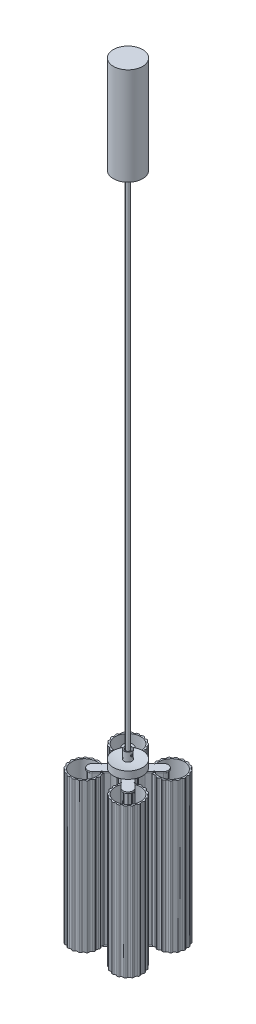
SolidWorks part; units mm, degrees
ref_plane "Alzado" through (0, 0, 0) normal (0, 0, 1) x (1, 0, 0)
ref_plane "Planta" through (0, 0, 0) normal (0, 1, 0) x (1, 0, 0)
ref_plane "Vista lateral" through (0, 0, 0) normal (1, 0, 0) x (0, 0, -1)
imported_body "Drawing1 (1).iges-1/Drawing1 (1)1.iges-1-surface1"
imported_body "Drawing1 (1).iges-1/Drawing1 (1)6.iges-1-solid1"
imported_body "Drawing1 (1).iges-1/Drawing1 (1)7.iges-1-solid1"
imported_body "Drawing1 (1).iges-1/Drawing1 (1)8.iges-1-surface1"
imported_body "Drawing1 (1).iges-1/Drawing1 (1)9.iges-1-surface1"
imported_body "Drawing1 (1).iges-1/Drawing1 (1)10.iges-1-surface1"
imported_body "Drawing1 (1).iges-1/Drawing1 (1)11.iges-1-surface1"
imported_body "Drawing1 (1).iges-1/Drawing1 (1)12.iges-1-surface1"
imported_body "Drawing1 (1).iges-1/Drawing1 (1)13.iges-1-surface1"
imported_body "Drawing1 (1).iges-1/Drawing1 (1)14.iges-1-surface1"
imported_body "Drawing1 (1).iges-1/Drawing1 (1)28.iges-1-solid1"
imported_body "Drawing1 (1).iges-1/Drawing1 (1)29.iges-1-solid1"
imported_body "Drawing1 (1).iges-1/Drawing1 (1)30.iges-1-solid1"
imported_body "Drawing1 (1).iges-1/Drawing1 (1)31.iges-1-solid1"
imported_body "Drawing1 (1).iges-1/Drawing1 (1)32.iges-1-solid1"
imported_body "Drawing1 (1).iges-1/Drawing1 (1)33.iges-1-solid1"
imported_body "Drawing1 (1).iges-1/Drawing1 (1)34.iges-1-solid1"
ref_plane "Plano1" through (0, 165, 0) normal (0, 1, 0) x (1, 0, 0)
sketch "Croquis1" plane through (0, 165, 0) normal (0, 1, 0) x (1, 0, 0)
  line L0 (2609.0394, 5910.9704) -> (2696.0135, 5997.9445) construction
  arc A12 (2608.6858, 5924.9004) -> (2622.9694, 5910.6169) centre (2616.1904, 5918.1214) ccw construction
  arc A13 (2696.3671, 5984.0145) -> (2682.0835, 5998.2981) centre (2688.8625, 5990.7936) ccw construction
  circle A14 centre (2697.313, 5999.244) radius 30
  circle A15 centre (2697.313, 5999.244) radius 26
  circle A16 centre (2652.5612, 5954.4547) radius 30 construction
  circle A17 centre (2697.3505, 5909.7029) radius 26
  circle A18 centre (2697.3505, 5909.7029) radius 30
  circle A19 centre (2607.8094, 5909.6654) radius 26
  circle A20 centre (2607.8094, 5909.6654) radius 30
  circle A21 centre (2607.7719, 5999.2065) radius 26
  circle A22 centre (2607.7719, 5999.2065) radius 30
  point P25 (2652.5612, 5954.4547)
  dimension "D1" = 60
  dimension "D2" = 52
  dimension "D3" = 4
extrude "Saliente-Extruir1" add sketch "Croquis1" along normal blind 306 separate body
sketch "Croquis2" plane through (0, 471, 0) normal (0, 1, 0) x (1, 0, 0)
  circle A47 centre (5954.4547, -2652.5612) radius 30
  circle A48 centre (-2652.5612, -5954.4547) radius 30
  circle A49 centre (-5954.4547, 2652.5612) radius 30
  circle A107 centre (2652.5612, 5954.4547) radius 30 construction
  circle A108 centre (2697.313, 5999.244) radius 32 construction
  circle A109 centre (2697.313, 6031.244) radius 4
  circle A110 centre (2708.8727, 6029.0831) radius 4
  circle A111 centre (2718.8713, 6022.8923) radius 4
  circle A112 centre (2725.9582, 6013.5076) radius 4
  circle A113 centre (2729.1765, 6002.1966) radius 4
  circle A114 centre (2728.0914, 5990.4868) radius 4
  circle A115 centre (2722.8495, 5979.9597) radius 4
  circle A116 centre (2714.1588, 5972.0371) radius 4
  circle A117 centre (2703.193, 5967.7889) radius 4
  circle A118 centre (2691.433, 5967.7889) radius 4
  circle A121 centre (2666.5346, 5990.4868) radius 4
  circle A122 centre (2665.4495, 6002.1966) radius 4
  circle A123 centre (2668.6678, 6013.5076) radius 4
  circle A124 centre (2675.7547, 6022.8923) radius 4
  circle A125 centre (2685.7533, 6029.0831) radius 4
  circle A126 centre (2680.4672, 5972.0371) radius 4
  circle A127 centre (2671.7764, 5979.9597) radius 4
  circle A128 centre (2688.5933, 5940.4813) radius 4
  circle A129 centre (2700.3031, 5941.5664) radius 4
  circle A130 centre (2711.6142, 5938.3481) radius 4
  circle A131 centre (2720.9988, 5931.2612) radius 4
  circle A132 centre (2727.1896, 5921.2626) radius 4
  circle A133 centre (2729.3505, 5909.7029) radius 4
  circle A134 centre (2727.1896, 5898.1432) radius 4
  circle A135 centre (2720.9988, 5888.1446) radius 4
  circle A136 centre (2711.6142, 5881.0577) radius 4
  circle A137 centre (2700.3031, 5877.8394) radius 4
  circle A138 centre (2688.5933, 5878.9245) radius 4
  circle A139 centre (2678.0662, 5884.1663) radius 4
  circle A140 centre (2670.1436, 5892.8571) radius 4
  circle A141 centre (2665.8954, 5903.8229) radius 4
  circle A142 centre (2665.8954, 5915.5829) radius 4
  circle A143 centre (2638.5878, 5918.4226) radius 4
  circle A144 centre (2639.6729, 5906.7128) radius 4
  circle A145 centre (2636.4546, 5895.4017) radius 4
  circle A146 centre (2629.3677, 5886.0171) radius 4
  circle A147 centre (2619.3691, 5879.8263) radius 4
  circle A148 centre (2607.8094, 5877.6654) radius 4
  circle A149 centre (2596.2497, 5879.8263) radius 4
  circle A150 centre (2586.2511, 5886.0171) radius 4
  circle A151 centre (2579.1642, 5895.4017) radius 4
  circle A152 centre (2575.9459, 5906.7128) radius 4
  circle A153 centre (2577.031, 5918.4226) radius 4
  circle A154 centre (2582.2729, 5928.9497) radius 4
  circle A155 centre (2590.9636, 5936.8723) radius 4
  circle A156 centre (2601.9294, 5941.1205) radius 4
  circle A157 centre (2613.6894, 5941.1205) radius 4
  circle A158 centre (2616.5291, 5968.4281) radius 4
  circle A159 centre (2604.8193, 5967.343) radius 4
  circle A160 centre (2593.5083, 5970.5613) radius 4
  circle A161 centre (2584.1236, 5977.6482) radius 4
  circle A162 centre (2577.9328, 5987.6468) radius 4
  circle A163 centre (2575.7719, 5999.2065) radius 4
  circle A164 centre (2577.9328, 6010.7662) radius 4
  circle A165 centre (2584.1236, 6020.7647) radius 4
  circle A166 centre (2593.5083, 6027.8517) radius 4
  circle A167 centre (2604.8193, 6031.07) radius 4
  circle A168 centre (2616.5291, 6029.9849) radius 4
  circle A169 centre (2627.0562, 6024.743) radius 4
  circle A170 centre (2634.9788, 6016.0523) radius 4
  circle A171 centre (2639.227, 6005.0865) radius 4
  circle A172 centre (2639.227, 5993.3265) radius 4
  point P33 (0, 0)
  point P47 (2697.313, 5999.244)
  point P161 (2652.5612, 5954.4547)
  dimension "D1" = 64
  dimension "D2" = 17
  dimension "D3" = 4
extrude "Cortar-Extruir1" cut sketch "Croquis2" against normal blind 306
ref_plane "Plano2" through (0, 175, 0) normal (0, 1, 0) x (1, 0, 0)
ref_plane "Plano3" through (0, 460, 0) normal (0, 1, 0) x (1, 0, 0)
fillet "Redondeo1" radius 4 30 edges at (2591.4855, 318, -6024.4008) (2597.4811, 318, -6027.3863) (2601.6866, 318, -6028.5828) (2608.3557, 318, -6029.2008) (2612.7094, 318, -6028.7974) (2619.1515, 318, -6026.9645) (2623.0655, 318, -6025.0155) (2628.4104, 318, -6020.9792) (2631.356, 318, -6017.748) (2634.8819, 318, -6012.0535) (2636.4614, 318, -6007.9764) (2637.6921, 318, -6001.3927) (2637.6921, 318, -5997.0203) (2636.4614, 318, -5990.4366) (2619.1515, 318, -5971.4485) (2612.7094, 318, -5969.6156) (2608.3557, 318, -5969.2122) (2601.6866, 318, -5969.8302) (2597.4811, 318, -5971.0267) (2591.4855, 318, -5974.0121) (2587.9963, 318, -5976.6471) (2583.4841, 318, -5981.5968) (2581.1823, 318, -5985.3143) (2578.7628, 318, -5991.5597) (2583.4841, 318, -6016.8162) (2587.9963, 318, -6021.7659) (2578.7628, 318, -6006.8533) (2581.1823, 318, -6013.0987) (2577.9594, 318, -5995.8576) (2577.9594, 318, -6002.5553)
fillet "Redondeo2" radius 4 30 edges at (2667.4303, 318, -5911.8891) (2668.661, 318, -5918.4728) (2668.661, 318, -5900.933) (2667.4303, 318, -5907.5167) (2673.7664, 318, -5891.1614) (2670.2405, 318, -5896.8559) (2682.0569, 318, -5883.8939) (2676.712, 318, -5887.9301) (2692.413, 318, -5880.112) (2685.9709, 318, -5881.9449) (2703.4358, 318, -5880.3266) (2696.7667, 318, -5879.7086) (2713.6369, 318, -5884.5086) (2707.6413, 318, -5881.5231) (2721.6383, 318, -5892.0932) (2717.1261, 318, -5887.1435) (2726.3596, 318, -5902.0561) (2723.9401, 318, -5895.8107) (2727.163, 318, -5913.0518) (2727.163, 318, -5906.354) (2723.9401, 318, -5923.5951) (2726.3596, 318, -5917.3497) (2685.9709, 318, -5937.4609) (2692.413, 318, -5939.2938) (2696.7667, 318, -5939.6972) (2703.4358, 318, -5939.0792) (2707.6413, 318, -5937.8827) (2713.6369, 318, -5934.8972) (2717.1261, 318, -5932.2623) (2721.6383, 318, -5927.3126)
fillet "Redondeo3" radius 4 30 edges at (2609.9956, 318, -5939.5856) (2616.5793, 318, -5938.3549) (2599.0395, 318, -5938.3549) (2605.6232, 318, -5939.5856) (2589.2679, 318, -5933.2495) (2594.9624, 318, -5936.7754) (2582.0004, 318, -5924.959) (2586.0367, 318, -5930.3039) (2630.3688, 318, -5889.8898) (2625.4191, 318, -5885.3776) (2635.9892, 318, -5899.3746) (2633.0037, 318, -5893.379) (2637.8037, 318, -5910.2492) (2637.1857, 318, -5903.58) (2635.5674, 318, -5921.045) (2637.4003, 318, -5914.6029) (2621.7016, 318, -5883.0758) (2615.4562, 318, -5880.6563) (2611.1583, 318, -5879.8529) (2604.4606, 318, -5879.8529) (2600.1626, 318, -5880.6563) (2593.9172, 318, -5883.0758) (2590.1997, 318, -5885.3776) (2585.25, 318, -5889.8898) (2578.2185, 318, -5914.6029) (2580.0514, 318, -5921.045) (2578.4331, 318, -5903.58) (2577.8151, 318, -5910.2492) (2582.6151, 318, -5893.379) (2579.6296, 318, -5899.3746)
fillet "Redondeo4" radius 4 30 edges at (2695.1268, 318, -5969.3238) (2688.5431, 318, -5970.5545) (2706.0829, 318, -5970.5545) (2699.4992, 318, -5969.3238) (2715.8545, 318, -5975.6599) (2710.16, 318, -5972.134) (2723.122, 318, -5983.9504) (2719.0857, 318, -5978.6055) (2726.9039, 318, -5994.3065) (2725.071, 318, -5987.8644) (2726.6893, 318, -6005.3293) (2727.3073, 318, -5998.6602) (2722.5073, 318, -6015.5304) (2725.4928, 318, -6009.5348) (2714.9227, 318, -6023.5318) (2719.8724, 318, -6019.0196) (2704.9598, 318, -6028.2531) (2711.2052, 318, -6025.8336) (2693.9641, 318, -6029.0565) (2700.6619, 318, -6029.0565) (2683.4208, 318, -6025.8336) (2689.6662, 318, -6028.2531) (2674.7536, 318, -6019.0196) (2679.7033, 318, -6023.5318) (2669.1332, 318, -6009.5348) (2672.1187, 318, -6015.5304) (2669.555, 318, -5987.8644) (2667.7221, 318, -5994.3065) (2667.3187, 318, -5998.6602) (2667.9367, 318, -6005.3293)
